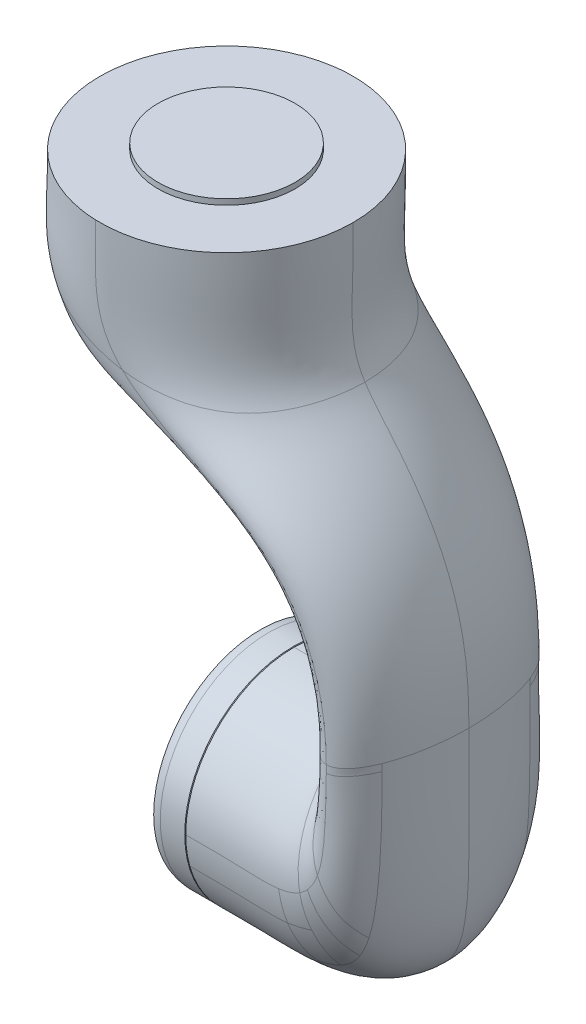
SolidWorks part; units mm, degrees
other "J4-1-solid1"
other "圆角1"
other "J4cover-1-solid1"
other "J5-1-solid1"
ref_plane "前视基准面" through (0, 0, 0) normal (0, 0, 1) x (1, 0, 0)
ref_plane "上视基准面" through (0, 0, 0) normal (0, 1, 0) x (1, 0, 0)
ref_plane "右视基准面" through (0, 0, 0) normal (1, 0, 0) x (0, 0, -1)
imported_body "输入1"
imported_body "输入2"
imported_body "输入3"
imported_body "输入4"
delete or keep bodies "实体-删除/保留 1" type delete bodies bodies 107 109
